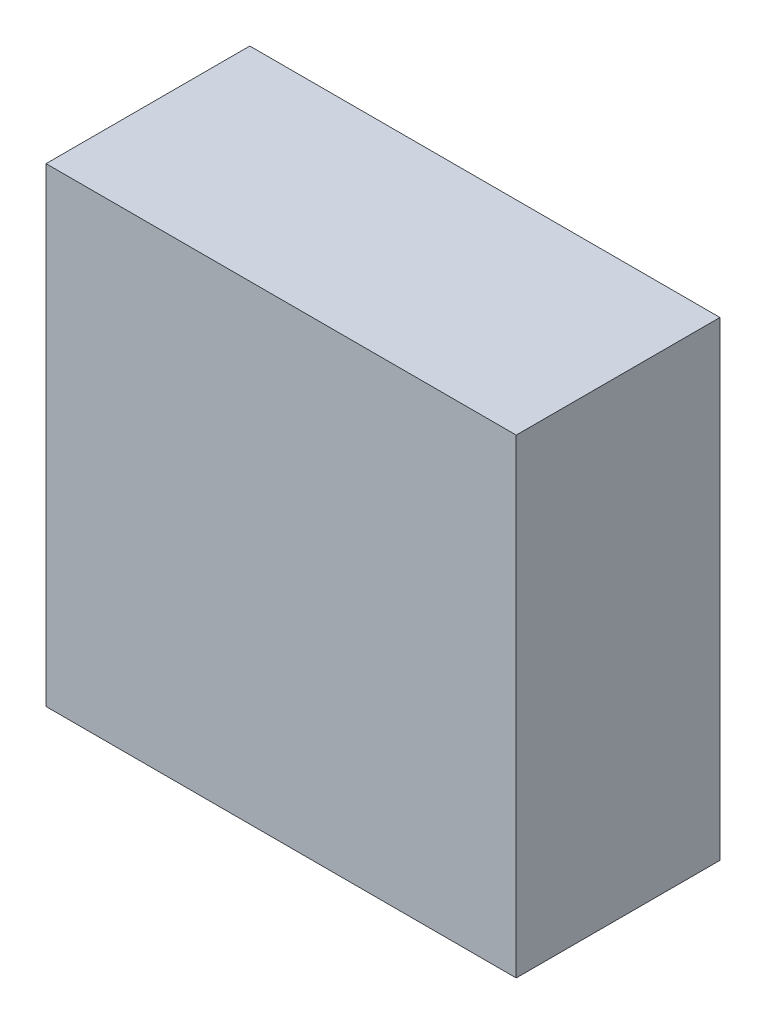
SolidWorks part; units mm, degrees
ref_plane "前视基准面" through (0, 0, 0) normal (0, 0, 1) x (1, 0, 0)
ref_plane "上视基准面" through (0, 0, 0) normal (0, 1, 0) x (1, 0, 0)
ref_plane "右视基准面" through (0, 0, 0) normal (1, 0, 0) x (0, 0, -1)
sketch "草图1" plane through (0, 0, 0) normal (0, 0, 1) x (1, 0, 0)
  line L1 (-1.5, 1.5) -> (1.5, 1.5)
  line L2 (-1.5, 1.5) -> (-1.5, -1.5)
  line L3 (-1.5, -1.5) -> (1.5, -1.5)
  line L4 (1.5, 1.5) -> (1.5, -1.5)
  line L5 (-1.5, 1.5) -> (1.5, -1.5) construction
  line L6 (-1.5, -1.5) -> (1.5, 1.5) construction
  point P0 (0, 0)
  dimension "D1" = 3
  dimension "D2" = 3
extrude "凸台-拉伸1" add sketch "草图1" along normal blind 1.3
